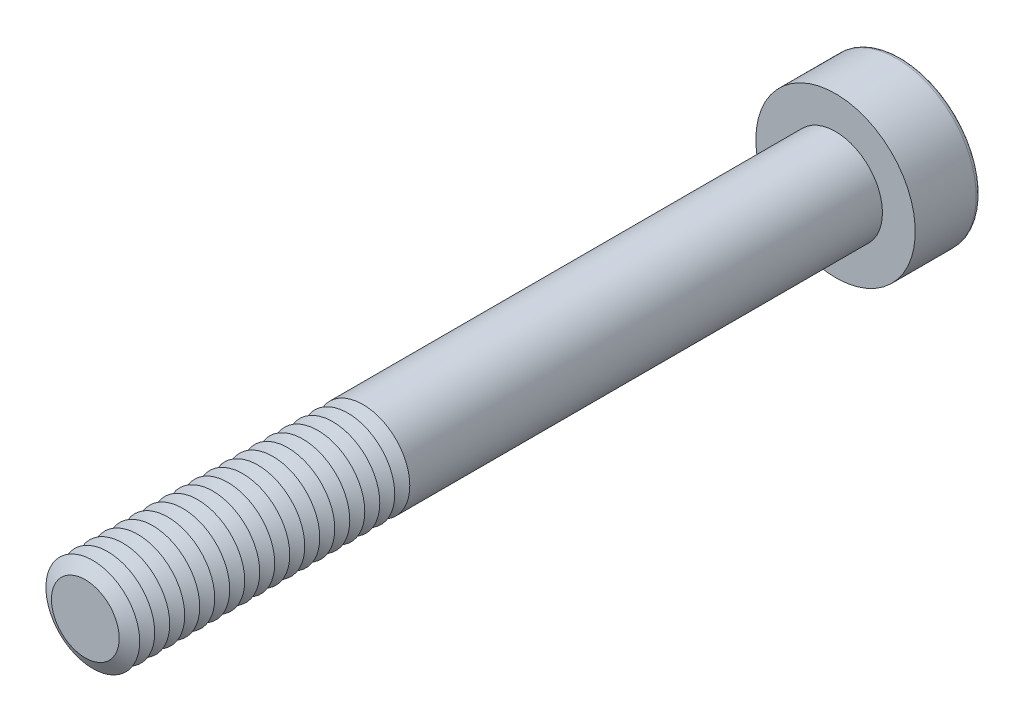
SolidWorks part; units mm, degrees
ref_plane "Front Plane" through (0, 0, 0) normal (0, 0, 1) x (1, 0, 0)
ref_plane "Top Plane" through (0, 0, 0) normal (0, 1, 0) x (1, 0, 0)
ref_plane "Right Plane" through (0, 0, 0) normal (1, 0, 0) x (0, 0, -1)
sketch "Sketch1" plane through (0, 0, 0) normal (0, 0, 1) x (1, 0, 0)
  circle A0 centre (0, 0) radius 2.5
  dimension "D1" = 5
extrude "Boss-Extrude1" add sketch "Sketch1" along normal blind 40
sketch "Sketch2" plane through (0, 0, 0) normal (0, 0, -1) x (-1, 0, 0)
  circle A0 centre (0, 0) radius 4.25
  dimension "D1" = 8.5
extrude "Boss-Extrude2" add sketch "Sketch2" along normal blind 3.5
sketch "Sketch3" plane through (0, 0, -3.5) normal (0, 0, -1) x (-1, 0, 0)
  line L1 (-0.866, 1.5) -> (-1.7321, 0)
  line L2 (-1.7321, 0) -> (-0.866, -1.5)
  line L3 (-0.866, -1.5) -> (0.866, -1.5)
  line L4 (0.866, -1.5) -> (1.7321, 0)
  line L5 (1.7321, 0) -> (0.866, 1.5)
  line L6 (0.866, 1.5) -> (-0.866, 1.5)
  circle A0 centre (0, 0) radius 1.5 construction
  dimension "D1" = 3
extrude "Cut-Extrude1" cut sketch "Sketch3" against normal blind 2.25
fillet "Fillet1" radius 0.25 1 edges at (-4.25, 0, -3.5)
sketch "Sketch4" plane through (0, 0, -1.25) normal (0, 0, -1) x (-1, 0, 0)
  line L0 (0.866, -1.5) -> (1.7321, 0) construction
  circle A0 centre (0, 0) radius 1.5
extrude "Cut-Extrude2" cut sketch "Sketch4" against normal through all draft 60
sketch "Sketch5" plane through (0, 0, -3.5) normal (0, 0, -1) x (-1, 0, 0)
  circle A0 centre (0, 0) radius 1.7321
extrude "Cut-Extrude3" cut sketch "Sketch5" against normal through all draft 75
sketch "Sketch7" plane through (0, 0, 0) normal (1, 0, 0) x (0, 0, -1)
  line L25 (-40, 1.8072) -> (-39.6, 2.5)
  line L26 (-40, 2.5) -> (-40, -2.5) construction
  line L27 (-39.6, 2.5) -> (-40.4, 2.5)
  line L28 (-40.4, 2.5) -> (-40, 1.8072)
  line L29 (0, 2.5) -> (-40, 2.5) construction
  dimension "D1" = 0.8
revolve "Cut-Revolve1" cut sketch "Sketch7" angle 360 about axis through (0, 0, 40) along (0, 0, -1)
pattern_linear "LPattern1" count 19 spacing 0.8 along (0, 0, -1) of "Cut-Revolve1"
